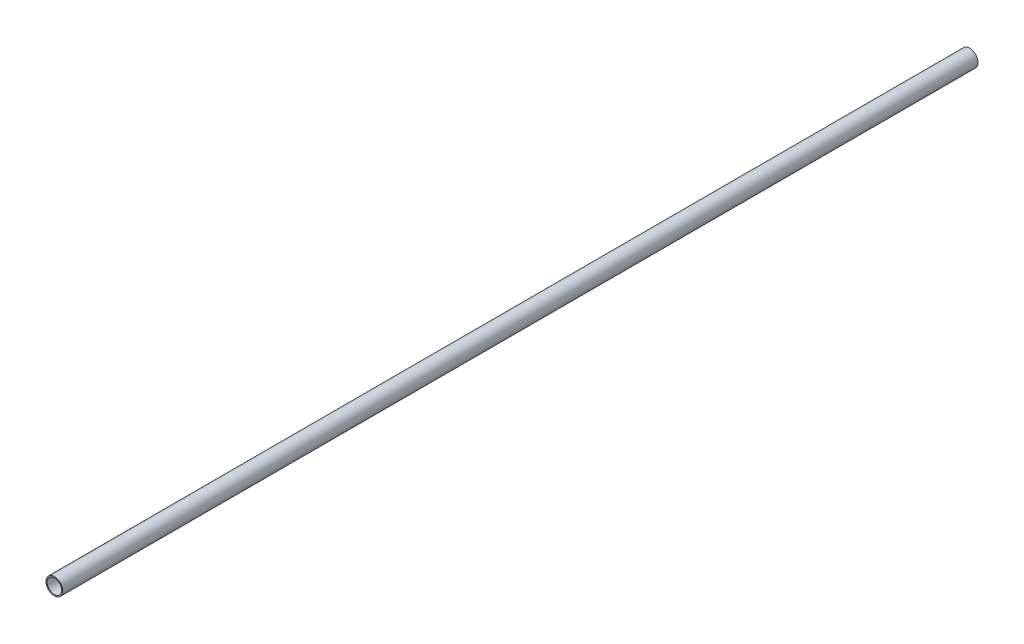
SolidWorks part; units mm, degrees
ref_plane "Front Plane" through (0, 0, 0) normal (0, 0, 1) x (1, 0, 0)
ref_plane "Top Plane" through (0, 0, 0) normal (0, 1, 0) x (1, 0, 0)
ref_plane "Right Plane" through (0, 0, 0) normal (1, 0, 0) x (0, 0, -1)
sketch "Sketch1" plane through (0, 0, 0) normal (0, 0, 1) x (1, 0, 0)
  circle A0 centre (0, 0) radius 9.525
  circle A1 centre (0, 0) radius 8.255
  dimension "D1" = 19.05
  dimension "D2" = 16.51
extrude "Boss-Extrude1" add sketch "Sketch1" along normal blind 1041.4
